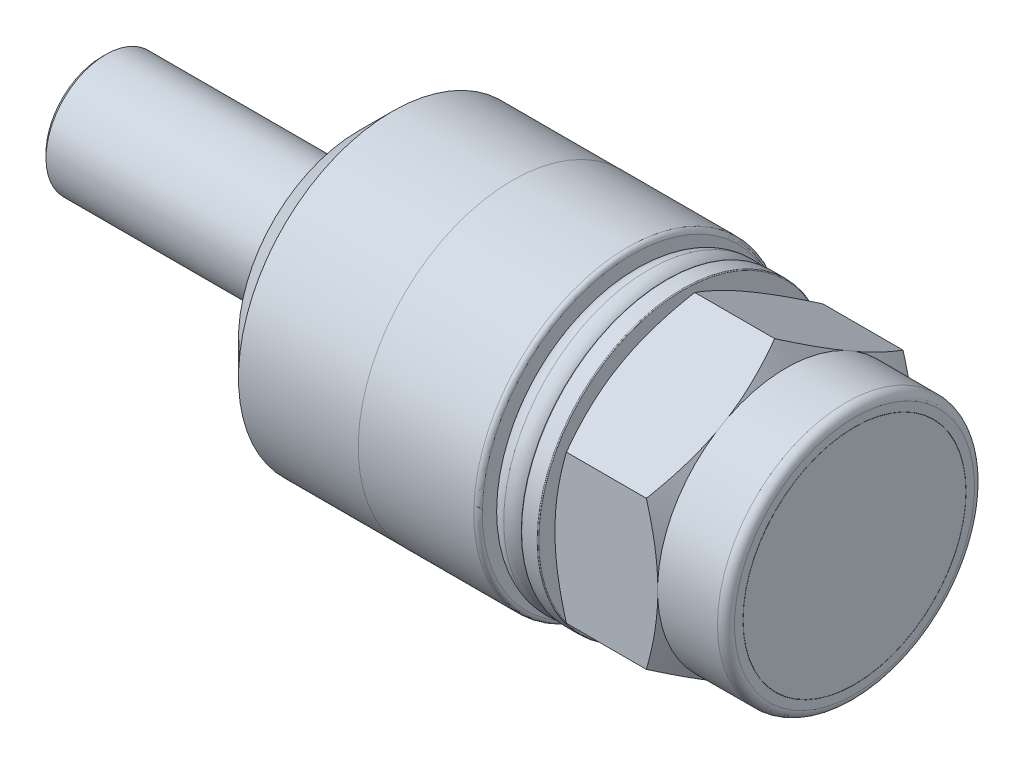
SolidWorks part; units mm, degrees
ref_plane "Front Plane" through (0, 0, 0) normal (0, 0, 1) x (1, 0, 0)
ref_plane "Top Plane" through (0, 0, 0) normal (0, 1, 0) x (1, 0, 0)
ref_plane "Right Plane" through (0, 0, 0) normal (1, 0, 0) x (0, 0, -1)
sketch "Sketch1" plane through (0, 0, 0) normal (0, 0, 1) x (1, 0, 0)
  line L0 (-30.9, 0) -> (-31, 0) construction
  line L1 (-31, 2.5) -> (-31, 3.25)
  line L2 (-30.75, 3.5) -> (-16.25, 3.5)
  line L3 (-16, 3.5) -> (-16, 7)
  line L4 (-7, 9) -> (-0.25, 9)
  line L5 (0, 8.75) -> (0, 7.501)
  line L6 (-16, 7) -> (-14.005, 8.995)
  line L7 (-16, 3.25) -> (-16, 3.5)
  line L8 (-16.25, 3.5) -> (-16, 3.25)
  line L9 (-31, 3.25) -> (-30.75, 3.5)
  line L10 (-14, 8.995) -> (-7, 8.995)
  line L11 (-7, 8.995) -> (-7, 9)
  line L12 (-14, 8.995) -> (-14.005, 8.995)
  line L13 (-31, 2.5) -> (-30.9, 2.5)
  line L14 (-30.9, 2.5) -> (-30.9, 0)
  line L15 (-30.9, 0) -> (3, 0)
  line L17 (0.999, 8.5) -> (1.001, 8.5)
  line L19 (2, 7.501) -> (2, 8.45)
  line L20 (2.05, 8.5) -> (2.95, 8.5)
  line L21 (3, 8.45) -> (3, 0)
  arc A0 (-0.25, 9) -> (0, 8.75) centre (-0.25, 8.75) cw
  arc A1 (1.001, 8.5) -> (2, 7.501) centre (1.001, 7.501) cw
  arc A2 (0, 7.501) -> (0.999, 8.5) centre (0.999, 7.501) cw
  arc A3 (2.95, 8.5) -> (3, 8.45) centre (2.95, 8.45) cw
  arc A4 (2.05, 8.5) -> (2, 8.45) centre (2.05, 8.45) ccw
  point P4 (-31, 3.5)
  point P6 (-16, 9)
  point P26 (2, 8.5)
  point P29 (0, 8.5)
  point P35 (3, 8.5)
  point P38 (2, 8.5)
  dimension "D10" = 0.25
  dimension "D14" = 19
  dimension "D16" = 0.999
  dimension "D18" = 0.05
  dimension "D2" = 7
  dimension "D3" = 18
  dimension "D4" = 15
  dimension "D5" = 7
  dimension "D6" = 0.005
  dimension "D11" = 2
  dimension "D12" = 0.1
  dimension "D13" = 2.5
  dimension "D15" = 2
  dimension "D17" = 1
revolve "Revolve1" add sketch "Sketch1" angle 360 about L0
sketch "Sketch2" plane through (3, 0, 0) normal (1, 0, 0) x (0, 0, -1)
  line L1 (0, 8.6603) -> (-7.5, 4.3301)
  line L2 (-7.5, 4.3301) -> (-7.5, -4.3301)
  line L3 (-7.5, -4.3301) -> (0, -8.6603)
  line L4 (0, -8.6603) -> (7.5, -4.3301)
  line L5 (7.5, -4.3301) -> (7.5, 4.3301)
  line L6 (7.5, 4.3301) -> (0, 8.6603)
  circle A0 centre (0, 0) radius 7.5 construction
  dimension "D1" = 15
extrude "Boss-Extrude1" add sketch "Sketch2" along normal blind 6
sketch "Sketch3" plane through (0, 0, 0) normal (0, 0, 1) x (1, 0, 0)
  line L0 (3, 8.7603) -> (3.7217, 8.7603)
  line L1 (3.7217, 8.7603) -> (3, 7.5103)
  line L2 (3, 4.5489) -> (3, 8.4415) construction
  line L3 (3, 7.5103) -> (3, 8.7603)
  line L4 (9, 8.6603) -> (3, 8.6603) construction
  line L5 (6, 8.6603) -> (6, -8.6603) construction
  line L6 (9, -8.6603) -> (3, -8.6603) construction
  line L7 (6, 0) -> (9, 0) construction
  line L8 (9, 4.3301) -> (9, -4.3301) construction
  line L9 (9, 7.5103) -> (9, 8.7603)
  line L10 (8.2783, 8.7603) -> (9, 7.5103)
  line L11 (9, 8.7603) -> (8.2783, 8.7603)
  dimension "D1" = 1.25
  dimension "D2" = 30
  dimension "D3" = 0.1
revolve "Cut-Revolve1" cut sketch "Sketch3" angle 360 about L7
sketch "Sketch4" plane through (0, 0, 0) normal (0, 0, 1) x (1, 0, 0)
  line L0 (9, 7.5103) -> (12.5, 7.5103)
  line L1 (13, 7.0103) -> (13, 6.5203)
  line L2 (9, 0) -> (13, 0) construction
  line L3 (9, 0.3923) -> (9, -0.3923) construction
  line L4 (13, 6.5203) -> (12.9, 6.5203)
  line L5 (12.9, 6.5203) -> (12.9, 6.5103)
  line L6 (12.9, 6.5103) -> (13, 6.5103)
  line L7 (13, 6.5103) -> (13, 0)
  line L9 (9, 7.5103) -> (9, 0)
  line L10 (9, 0) -> (9, 7.5103)
  arc A0 (12.5, 7.5103) -> (13, 7.0103) centre (12.5, 7.0103) cw
  point P10 (13, 7.5103)
  dimension "D2" = 0.5
  dimension "D1" = 4
  dimension "D3" = 0.01
  dimension "D4" = 0.1
  dimension "D5" = 1
revolve "Revolve2" add sketch "Sketch4" angle 360 about L2
